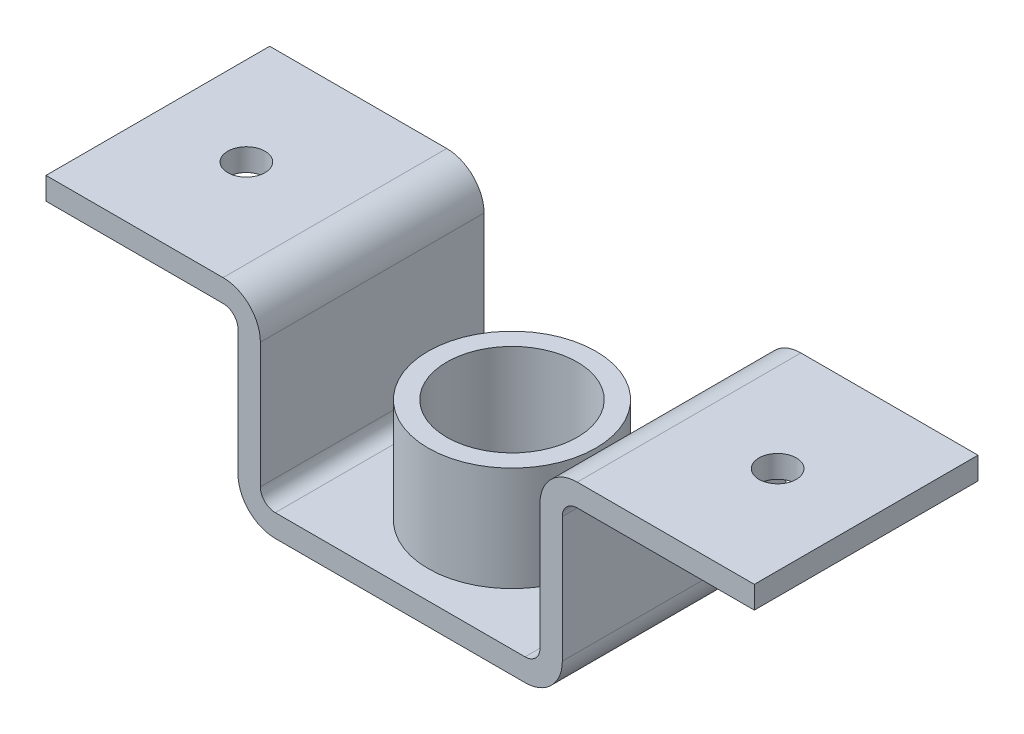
SolidWorks part; units mm, degrees
ref_plane "Front Plane" through (0, 0, 0) normal (0, 0, 1) x (1, 0, 0)
ref_plane "Top Plane" through (0, 0, 0) normal (0, 1, 0) x (1, 0, 0)
ref_plane "Right Plane" through (0, 0, 0) normal (1, 0, 0) x (0, 0, -1)
sketch "Sketch1" plane through (0, 0, 0) normal (0, 0, 1) x (1, 0, 0)
  line L0 (-217.5, 0) -> (217.5, 0)
  line L1 (217.5, 0) -> (217.5, 238)
  line L2 (217.5, 238) -> (475, 238)
  line L3 (0, 0) -> (0, 255915.7636) construction
  line L4 (-217.5, 238) -> (-475, 238)
  line L5 (-217.5, 0) -> (-217.5, 238)
  line L6 (187.5, 268) -> (475, 268)
  line L7 (187.5, 30) -> (187.5, 268)
  line L8 (-187.5, 30) -> (187.5, 30)
  line L9 (-187.5, 30) -> (-187.5, 268)
  line L10 (-187.5, 268) -> (-475, 268)
  line L11 (-475, 238) -> (-475, 268)
  line L12 (475, 268) -> (475, 238)
  point P10 (0, 0)
  dimension "D1" = 950
  dimension "D2" = 238
  dimension "D3" = 375
  dimension "D4" = 30
extrude "Boss-Extrude1" add sketch "Sketch1" along normal mid plane 300
fillet "Fillet1" radius 20 4 edges at (-217.5, 238, 0) (217.5, 238, 0) (187.5, 30, 0) (-187.5, 30, 0)
fillet "Fillet2" radius 50 4 edges at (-217.5, 0, 0) (217.5, 0, 0) (187.5, 268, 0) (-187.5, 268, 0)
sketch "Sketch2" plane through (0, 30, 0) normal (0, 1, 0) x (1, 0, 0)
  circle A0 centre (0, 0) radius 37.5
  dimension "D1" = 75
extrude "Cut-Extrude2" cut sketch "Sketch2" against normal up to surface (30 mm away)
sketch "Sketch3" plane through (0, 30, 0) normal (0, 1, 0) x (1, 0, 0)
  circle A0 centre (0, 0) radius 87.5
  circle A1 centre (0, 0) radius 112.5
  dimension "D1" = 175
  dimension "D2" = 225
extrude "Boss-Extrude2" add sketch "Sketch3" along normal blind 140
sketch "Sketch4" plane through (0, 268, 0) normal (0, 1, 0) x (1, 0, 0)
  line L0 (-475, 150) -> (-237.5, -150) construction
  circle A0 centre (-356.25, 0) radius 25
  dimension "D1" = 50
extrude "Cut-Extrude3" cut sketch "Sketch4" against normal up to surface (30 mm away)
mirror "Mirror1" about plane through (0, 0, 0) normal (1, 0, 0) of "Cut-Extrude3"
